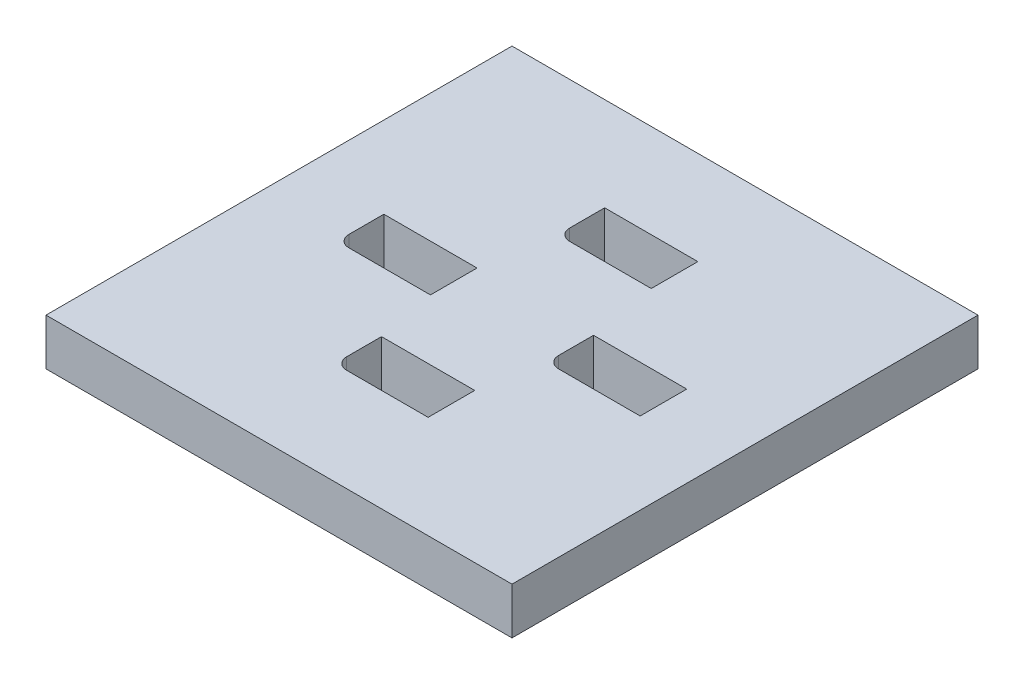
SolidWorks part; units mm, degrees
ref_plane "Front" through (0, 0, 0) normal (0, 0, 1) x (1, 0, 0)
ref_plane "Top" through (0, 0, 0) normal (0, 1, 0) x (1, 0, 0)
ref_plane "Right" through (0, 0, 0) normal (1, 0, 0) x (0, 0, -1)
sketch "Sketch1" plane through (0, 0, 0) normal (0, 1, 0) x (1, 0, 0)
  line L1 (-63.5, -63.5) -> (63.5, -63.5)
  line L2 (-63.5, -63.5) -> (-63.5, 63.5)
  line L3 (-63.5, 63.5) -> (63.5, 63.5)
  line L4 (63.5, -63.5) -> (63.5, 63.5)
  line L5 (-63.5, -63.5) -> (63.5, 63.5) construction
  line L6 (-63.5, 63.5) -> (63.5, -63.5) construction
  point P0 (0, 0)
  dimension "D1" = 127
  dimension "D2" = 127
extrude "Boss-Extrude1" add sketch "Sketch1" along normal blind 12.7
sketch "Sketch2" plane through (0, 12.7, 0) normal (0, 1, 0) x (1, 0, 0)
  line L0 (0, 2.3899) -> (0, -42.6815) construction
  line L1 (12.7, -22.86) -> (12.7, -35.56)
  line L2 (-12.7, -22.86) -> (12.7, -22.86)
  line L3 (-12.7, -22.86) -> (-12.7, -32.385)
  line L4 (-9.525, -35.56) -> (12.7, -35.56)
  line L5 (0, 2.3899) -> (58.7662, 2.3899) construction
  line L10 (28.575, 17.2197) -> (28.575, -18.3251) construction
  line L11 (15.875, 6.35) -> (41.275, 6.35)
  line L12 (15.875, 6.35) -> (15.875, -3.175)
  line L13 (19.05, -6.35) -> (41.275, -6.35)
  line L14 (41.275, 6.35) -> (41.275, -6.35)
  line L15 (-41.275, 6.35) -> (-41.275, -3.175)
  line L16 (-15.875, -6.35) -> (-38.1, -6.35)
  line L17 (-15.875, 6.35) -> (-15.875, -6.35)
  line L18 (-15.875, 6.35) -> (-41.275, 6.35)
  line L19 (0, 63.5) -> (0, -63.5) construction
  line L20 (63.5, 63.5) -> (-63.5, 63.5) construction
  line L21 (-63.5, -63.5) -> (63.5, -63.5) construction
  line L22 (12.7, 37.9499) -> (12.7, 25.2499)
  line L23 (-12.7, 37.9499) -> (12.7, 37.9499)
  line L24 (-12.7, 37.9499) -> (-12.7, 28.4249)
  line L25 (-9.525, 25.2499) -> (12.7, 25.2499)
  line L26 (-9.525, -32.385) -> (-9.525, 28.4249) construction
  arc A1 (-12.7, -32.385) -> (-9.525, -35.56) centre (-9.525, -32.385) ccw
  arc A4 (19.05, -6.35) -> (15.875, -3.175) centre (19.05, -3.175) cw
  arc A8 (-41.275, -3.175) -> (-38.1, -6.35) centre (-38.1, -3.175) ccw
  arc A17 (-12.7, 28.4249) -> (-9.525, 25.2499) centre (-9.525, 28.4249) ccw
  dimension "D1" = 22.86
extrude "Cut-Extrude1" cut sketch "Sketch2" against normal through all
